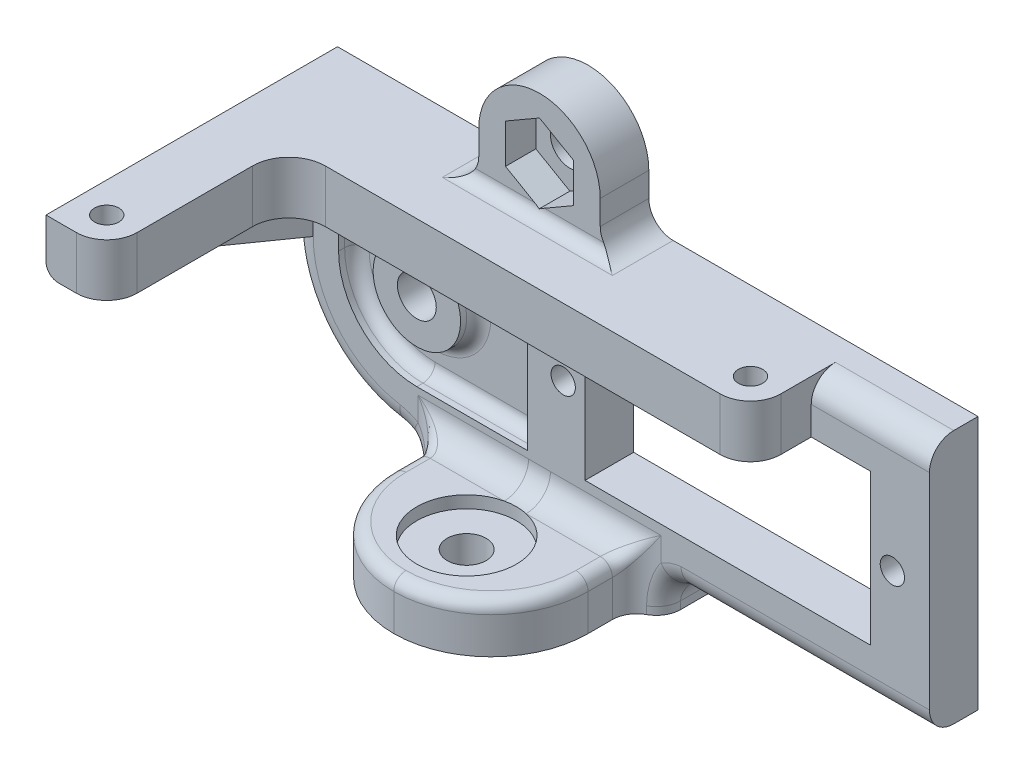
SolidWorks part; units mm, degrees
ref_plane "Plan de face" through (0, 0, 0) normal (0, 0, 1) x (1, 0, 0)
ref_plane "Plan de dessus" through (0, 0, 0) normal (0, 1, 0) x (1, 0, 0)
ref_plane "Plan de droite" through (0, 0, 0) normal (1, 0, 0) x (0, 0, -1)
sketch "Esquisse1" plane through (0, 0, 0) normal (0, 0, 1) x (1, 0, 0)
  line L0 (0, -27.1129) -> (0, 59.6143) construction
  line L1 (-37.8012, 0) -> (60.4749, 0) construction
  line L2 (10.1, -16.7345) -> (10.1, 13.4421) construction
  line L3 (-10.1, -17.307) -> (-10.1, 18.9396) construction
  line L4 (60.4749, 10.53) -> (-28.4878, 10.53) construction
  line L5 (60.4749, -13) -> (-21.8797, -13) construction
  line L6 (6.7082, -9) -> (-15.3674, -9) construction
  line L7 (-10.1, -12.3694) -> (-10.1, -13)
  line L8 (10.1, -12.3694) -> (10.1, -13)
  line L9 (-20.63, 10.53) -> (-7, 10.53)
  line L10 (-10.1, -13) -> (10.1, -13)
  line L11 (7, 10.53) -> (32.1, 10.53)
  line L12 (27.25, 18.9396) -> (27.25, -7.8833) construction
  line L13 (37.4995, -6.2) -> (2.6362, -6.2) construction
  line L14 (37.4995, 6.2) -> (2.6362, 6.2) construction
  line L15 (29.05, 18.9396) -> (29.05, -22.4758) construction
  line L16 (1.95, -22.4758) -> (1.95, 6.6493) construction
  line L17 (3.75, -7.5255) -> (3.75, 18.9396) construction
  line L18 (41.1446, -10.395) -> (5, -10.395) construction
  line L19 (3.75, 6.2) -> (27.25, 6.2)
  line L20 (3.75, 6.2) -> (3.75, -6.2)
  line L21 (3.75, -6.2) -> (27.25, -6.2)
  line L22 (27.25, 6.2) -> (27.25, -6.2)
  line L23 (32.1, -22.4758) -> (32.1, 12.53) construction
  line L24 (32.1, 10.53) -> (32.1, -10.395)
  line L25 (32.1, -10.395) -> (11.7808, -10.395)
  line L26 (-5.7238, 14.53) -> (37.4995, 14.53) construction
  line L27 (5, 14.53) -> (5, 12.53)
  line L28 (-5, 14.53) -> (-5, 12.53)
  line L29 (-20.63, 30.6745) -> (-20.63, -14.2564) construction
  line L30 (18.2125, 33.4678) -> (18.2125, 2.2635) construction
  line L31 (-20.63, 0) -> (-20.63, 10.53)
  arc A0 (5, 12.53) -> (7, 10.53) centre (7, 12.53) ccw
  circle A1 centre (-10.1, 0) radius 1.6
  circle A2 centre (10.1, 0) radius 10.8 construction
  circle A3 centre (-10.1, 0) radius 10.8 construction
  circle A4 centre (29.05, 0) radius 1
  arc A5 (-20.63, 0) -> (-11.7808, -10.395) centre (-10.1, 0) ccw
  arc A6 (11.7808, -10.395) -> (10.1, -12.3694) centre (12.1, -12.3694) ccw
  arc A7 (-10.1, -12.3694) -> (-11.7808, -10.395) centre (-12.1, -12.3694) ccw
  arc A8 (5, 14.53) -> (-5, 14.53) centre (0, 14.53) ccw
  circle A9 centre (0, 14.53) radius 1.6
  arc A10 (-5, 12.53) -> (-7, 10.53) centre (-7, 12.53) cw
  circle A12 centre (1.95, 0) radius 1
  point P29 (10.1, -10.53)
  point P32 (-10.1, -10.53)
  point P40 (5, 10.53)
  point P70 (-5, 10.53)
  dimension "D3" = 13
  dimension "D4" = 4
  dimension "D6" = 2
  dimension "D7" = 2
  dimension "D12" = 27.1
  dimension "D14" = 3.05
  dimension "D1" = 10.1
  dimension "D2" = 10.1
  dimension "D5" = 10.53
  dimension "D8" = 1.8
  dimension "D9" = 6.2
  dimension "D10" = 12.4
  dimension "D11" = 18.95
  dimension "D13" = 23.5
  dimension "D15" = 4
extrude "Boss.-Extru.1" add sketch "Esquisse1" along normal blind 4
sketch "Esquisse2" plane through (0, 0, 4) normal (0, 0, 1) x (1, 0, 0)
  line L0 (0, -20.8278) -> (0, -6.8042) construction
  line L1 (12.9107, -13) -> (-27.1311, -13) construction
  line L2 (-27.1311, -9) -> (5.5111, -9) construction
  line L3 (-8, -20.8278) -> (-8, 0.5955) construction
  line L4 (-6, -15.5167) -> (-6, 0.5955) construction
  line L5 (-8, -9) -> (-8, -13)
  line L6 (8, -9) -> (8, -13)
  line L7 (-8, -13) -> (8, -13)
  line L8 (-8, -9) -> (8, -9)
  dimension "D1" = 4
  dimension "D2" = 8
  dimension "D3" = 2
extrude "Boss.-Extru.2" add sketch "Esquisse2" along normal blind 12
sketch "Esquisse3" plane through (0, -9, 0) normal (0, 1, 0) x (1, 0, 0)
  line L0 (14.7606, -10) -> (-5.7675, -10) construction
  line L1 (0, -20.9092) -> (0, -7.184) construction
  circle A0 centre (0, -10) radius 1.6
extrude "Enlèv. mat.-Extru.1" cut sketch "Esquisse3" against normal blind 4
sketch "Esquisse4" plane through (0, -9, 0) normal (0, 1, 0) x (1, 0, 0)
  circle A0 centre (0, -10) radius 4.1
extrude "Enlèv. mat.-Extru.2" cut sketch "Esquisse4" against normal blind 1
fillet "Congé1" radius 2 3 edges at (0, -9, 4)
fillet "Congé2" radius 8 2 edges at (8, -11, 16) (-8, -11, 16)
sketch "Esquisse5" plane through (0, 0, 4) normal (0, 0, 1) x (1, 0, 0)
  line L0 (0, 13.2837) -> (0, -15.2928) construction
  line L1 (-16.543, 0) -> (-16.543, 6.443)
  line L3 (-10.1, -6.443) -> (-1, -6.443)
  line L5 (-16.543, 6.443) -> (-1, 6.443)
  line L6 (-1, 6.443) -> (-1, -6.443)
  circle A3 centre (-10.1, 0) radius 3.6
  arc A4 (-10.1, -6.443) -> (-16.543, 0) centre (-10.1, 0) cw
extrude "Enlèv. mat.-Extru.3" cut sketch "Esquisse5" against normal blind 1.5
sketch "Esquisse6" plane through (0, 0, 4) normal (0, 0, 1) x (1, 0, 0)
  line L0 (0, 5.9788) -> (0, 22.4054) construction
  line L2 (0, 17.7632) -> (-2.8, 16.1466)
  line L3 (-2.8, 16.1466) -> (-2.8, 12.9134)
  line L4 (-2.8, 12.9134) -> (0, 11.2968)
  line L5 (0, 11.2968) -> (2.8, 12.9134)
  line L6 (2.8, 12.9134) -> (2.8, 16.1466)
  line L7 (2.8, 16.1466) -> (0, 17.7632)
  circle A0 centre (0, 14.53) radius 2.8 construction
extrude "Enlèv. mat.-Extru.4" cut sketch "Esquisse6" against normal blind 2.5
sketch "Esquisse7" plane through (0, 0, 0) normal (0, 0, -1) x (-1, 0, 0)
  line L0 (-35.7559, 10.53) -> (22.7361, 10.53) construction
  line L1 (20.63, 6.2) -> (-22.37, 6.2)
  line L2 (20.63, 6.2) -> (20.63, 10.53)
  line L3 (20.63, 10.53) -> (-22.37, 10.53)
  line L4 (-22.37, 6.2) -> (-22.37, 10.53)
  line L5 (-35.7559, 6.2) -> (22.7361, 6.2) construction
  line L6 (20.63, 10.53) -> (20.63, 0) construction
extrude "Boss.-Extru.3" add sketch "Esquisse7" against normal blind 24
sketch "Esquisse8" plane through (0, 10.53, 0) normal (0, 1, 0) x (1, 0, 0)
  line L0 (-20.63, 4.27) -> (-20.63, -31.6915) construction
  line L1 (19.87, -9) -> (-12.63, -9)
  line L2 (34.0197, -4) -> (-22.7558, -4) construction
  line L3 (34.0197, -9) -> (-18.7783, -9) construction
  line L4 (-26.9513, -24) -> (-18.13, -24) construction
  line L5 (-20.63, -24) -> (22.37, -24) construction
  line L6 (-27.4417, -21.5) -> (-13.6565, -21.5) construction
  line L7 (-18.13, -26.7876) -> (-18.13, -19.105) construction
  line L8 (22.37, -24) -> (22.37, -4) construction
  line L9 (19.87, -26.2428) -> (19.87, -5.1018) construction
  line L10 (28.1896, -6.5) -> (18.2184, -6.5) construction
  line L11 (-15.63, -21.5) -> (-15.63, -12)
  line L12 (-12.63, -9) -> (19.87, -9) construction
  line L13 (22.37, -6.5) -> (22.37, -24)
  line L14 (22.37, -24) -> (-18.13, -24)
  circle A0 centre (-18.13, -21.5) radius 1
  circle A1 centre (19.87, -6.5) radius 1
  arc A2 (19.87, -9) -> (22.37, -6.5) centre (19.87, -6.5) ccw
  arc A3 (-18.13, -24) -> (-15.63, -21.5) centre (-18.13, -21.5) ccw
  arc A4 (-15.63, -12) -> (-12.63, -9) centre (-12.63, -12) cw
  point P36 (-15.63, -9)
  dimension "D7" = 3
  dimension "D1" = 5
  dimension "D3" = 2.5
  dimension "D4" = 2.5
  dimension "D6" = 2.5
extrude "Enlèv. mat.-Extru.5" cut sketch "Esquisse8" against normal blind 4.5
sketch "Esquisse9" plane through (-20.63, 0, 0) normal (-1, 0, 0) x (0, 0, 1)
  line L0 (4, 0) -> (4, 6.2)
  line L1 (4, 6.2) -> (19, 6.2)
  line L3 (19, 6.2) -> (4, 0)
  line L4 (24, 6.2) -> (4, 6.2) construction
extrude "Boss.-Extru.4" add sketch "Esquisse9" against normal blind 2
fillet "Congé3" radius 1 15 edges at (-16.543, 3.1, 2.5) (-14.6559, -4.5559, 2.5) (-8.5858, -8.4142, 4.5858) (-8, -9, 7) (8.5858, -8.4142, 4.5858) (8, -9, 7) (5.6569, -9, 13.6569) (-13.7, 0, 2.5) (-8.7715, 6.2, 2.5) (-5.55, -6.443, 2.5) (-1, -0.1215, 2.5) (-5.6569, -9, 13.6569) (-20.63, 6.2, 21.5) (-20.63, 3.1, 11.5) (0, 10.53, 4)
fillet "Congé4" radius 2 7 edges at (-18.3758, -6.5109, 4) (-10.1, -12.6847, 4) (10.1, -12.6847, 4) (-10.5771, -11.0729, 4) (27.235, 10.53, 4) (10.5771, -11.0729, 4) (21.9404, -10.395, 4)
